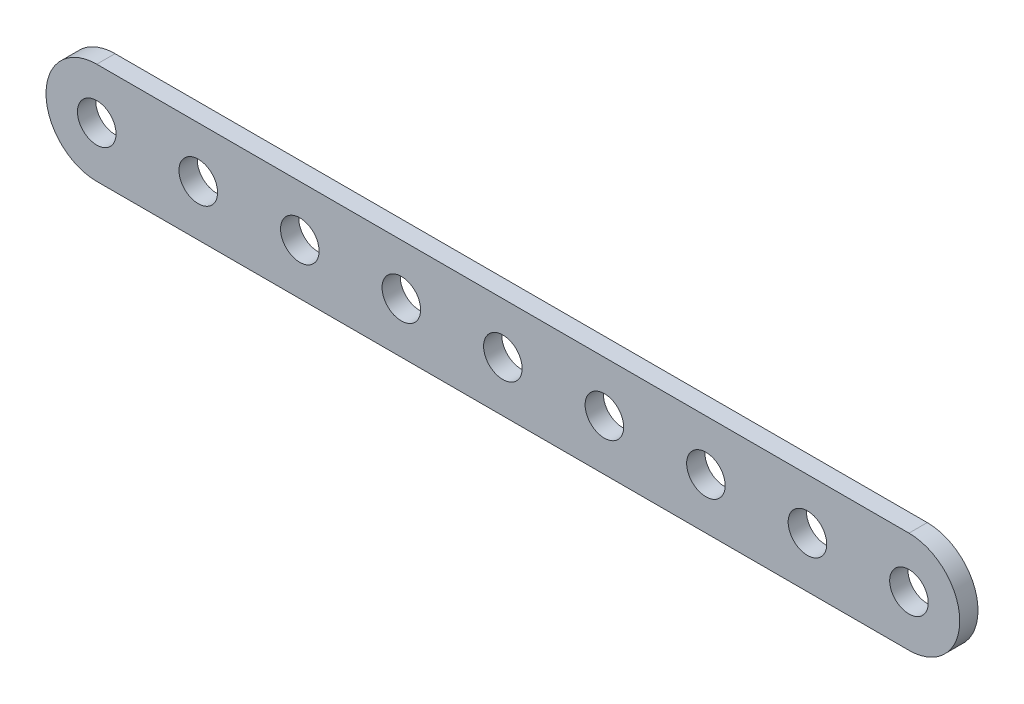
SolidWorks part; units mm, degrees
ref_plane "Front Plane" through (0, 0, 0) normal (0, 0, 1) x (1, 0, 0)
ref_plane "Top Plane" through (0, 0, 0) normal (0, 1, 0) x (1, 0, 0)
ref_plane "Right Plane" through (0, 0, 0) normal (1, 0, 0) x (0, 0, -1)
sketch "Sketch1" plane through (0, 0, 0) normal (0, 0, 1) x (1, 0, 0)
  line L0 (-50.8, 0) -> (50.8, 0) construction
  line L1 (-50.8, -6.35) -> (50.8, -6.35)
  line L3 (-50.8, 6.35) -> (50.8, 6.35)
  arc A0 (50.8, 6.35) -> (50.8, -6.35) centre (50.8, 0) cw
  arc A1 (-50.8, 6.35) -> (-50.8, -6.35) centre (-50.8, 0) ccw
  dimension "D2" = 6.35
  dimension "D1" = 101.6
extrude "Boss-Extrude1" add sketch "Sketch1" along normal blind 2.286
sketch "Sketch2" plane through (0, 0, 2.286) normal (0, 0, 1) x (1, 0, 0)
  circle A0 centre (-50.8, 0) radius 2.413
  dimension "D1" = 4.826
  dimension "D2" = 4.826
extrude "Cut-Extrude1" cut sketch "Sketch2" against normal through all
pattern_linear "LPattern1" count 9 spacing 12.7 along (1, 0, 0) of "Cut-Extrude1"
